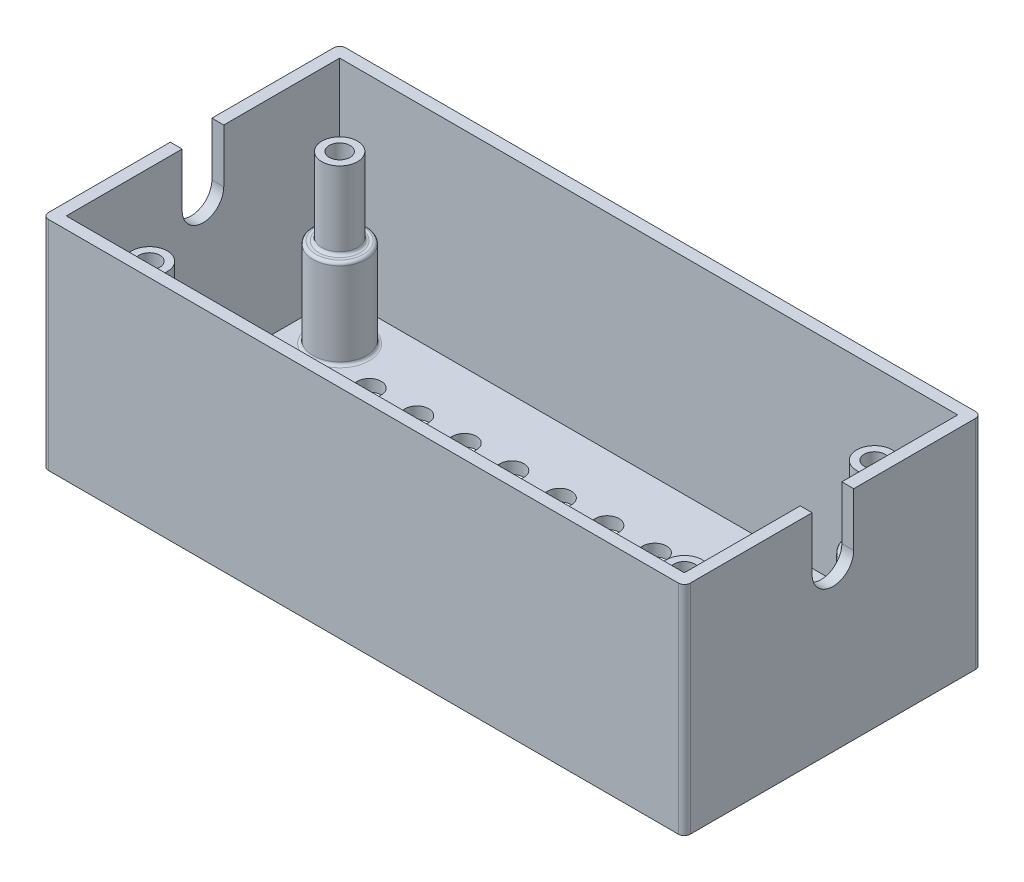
SolidWorks part; units mm, degrees
ref_plane "Спереди" through (0, 0, 0) normal (0, 0, 1) x (1, 0, 0)
ref_plane "Сверху" through (0, 0, 0) normal (0, 1, 0) x (1, 0, 0)
ref_plane "Справа" through (0, 0, 0) normal (1, 0, 0) x (0, 0, -1)
sketch "Эскиз1" plane through (0, 0, 0) normal (0, 1, 0) x (1, 0, 0)
  line L1 (-54, 25) -> (54, 25)
  line L2 (-54, 25) -> (-54, -25)
  line L3 (-54, -25) -> (54, -25)
  line L4 (54, 25) -> (54, -25)
  line L5 (-54, 25) -> (54, -25) construction
  line L6 (-54, -25) -> (54, 25) construction
  point P0 (0, 0)
  dimension "D1" = 108
  dimension "D2" = 50
extrude "Бобышка-Вытянуть1" add sketch "Эскиз1" along normal blind 2
sketch "Эскиз2" plane through (0, 2, 0) normal (0, 1, 0) x (1, 0, 0)
  line L0 (52, 23) -> (-52, 23)
  line L1 (-52, 23) -> (-52, -23)
  line L2 (-52, -23) -> (52, -23)
  line L3 (52, -23) -> (52, 23)
  line L4 (54, -25) -> (54, 25)
  line L5 (54, 25) -> (-54, 25)
  line L6 (-54, 25) -> (-54, -25)
  line L7 (-54, -25) -> (54, -25)
  line L8 (54, -25) -> (54, 25)
  line L9 (54, 25) -> (-54, 25)
  line L10 (-54, 25) -> (-54, -25)
  line L11 (-54, -25) -> (54, -25)
  dimension "D1" = 0
  dimension "D2" = 2
extrude "Бобышка-Вытянуть2" add sketch "Эскиз2" along normal blind 34.6
sketch "Эскиз3" plane through (0, 2, 0) normal (0, 1, 0) x (1, 0, 0)
  line L1 (-45, 16) -> (45, 16) construction
  line L2 (-45, 16) -> (-45, -16) construction
  line L3 (-45, -16) -> (45, -16) construction
  line L4 (45, 16) -> (45, -16) construction
  line L5 (-45, 16) -> (45, -16) construction
  line L6 (-45, -16) -> (45, 16) construction
  circle A0 centre (-45, 16) radius 3
  circle A1 centre (45, 16) radius 3
  circle A2 centre (45, -16) radius 3
  circle A3 centre (-45, -16) radius 3
  point P0 (0, 0)
  dimension "D3" = 6
  dimension "D1" = 32
  dimension "D2" = 90
extrude "Бобышка-Вытянуть3" add sketch "Эскиз3" along normal blind 28
sketch "Эскиз4" plane through (0, 30, 0) normal (0, 1, 0) x (1, 0, 0)
  circle A0 centre (-45, 16) radius 1.75
  circle A1 centre (45, 16) radius 1.75
  circle A2 centre (45, -16) radius 1.75
  circle A3 centre (-45, -16) radius 1.75
  dimension "D1" = 3.5
extrude "Вырез-Вытянуть1" cut sketch "Эскиз4" against normal through all
sketch "Эскиз5" plane through (0, 0, 0) normal (0, -1, 0) x (1, 0, 0)
  circle A0 centre (-45, 16) radius 2.95
  circle A1 centre (-45, -16) radius 2.95
  circle A2 centre (45, -16) radius 2.95
  circle A3 centre (45, 16) radius 2.95
  dimension "D1" = 5.9
extrude "Вырез-Вытянуть2" cut sketch "Эскиз5" against normal blind 15
sketch "Эскиз6" plane through (0, 2, 0) normal (0, 1, 0) x (1, 0, 0)
  circle A0 centre (-45, 16) radius 4.5
  circle A1 centre (45, 16) radius 4.5
  circle A2 centre (45, -16) radius 4.5
  circle A3 centre (-45, -16) radius 4.5
  circle A4 centre (45, -16) radius 3 construction
  circle A5 centre (45, 16) radius 3 construction
  circle A6 centre (-45, -16) radius 3 construction
  circle A7 centre (-45, 16) radius 3 construction
  circle A8 centre (45, -16) radius 3
  circle A9 centre (45, 16) radius 3
  circle A10 centre (-45, -16) radius 3
  circle A11 centre (-45, 16) radius 3
  dimension "D1" = 9
extrude "Бобышка-Вытянуть4" add sketch "Эскиз6" along normal blind 15
sketch "Эскиз7" plane through (-54, 0, 0) normal (-1, 0, 0) x (0, 0, 1)
  line L0 (0, 36.6) -> (0, 0) construction
  line L1 (-25, 36.6) -> (25, 36.6) construction
  line L2 (-25, 0) -> (25, 0) construction
  line L3 (-3.5, 36.6) -> (3.5, 36.6)
  line L4 (-3.5, 36.6) -> (-3.5, 27.6)
  line L5 (-3.5, 27.6) -> (3.5, 27.6) construction
  line L6 (3.5, 27.6) -> (3.5, 36.6)
  arc A0 (-3.5, 27.6) -> (3.5, 27.6) centre (0, 27.6) ccw
  point P8 (0, 36.6)
  dimension "D1" = 7
  dimension "D2" = 9
extrude "Вырез-Вытянуть3" cut sketch "Эскиз7" against normal through all
sketch "Эскиз8" plane through (0, 0, 0) normal (0, -1, 0) x (1, 0, 0)
  line L0 (0, 25) -> (0, -25) construction
  line L1 (-54, 25) -> (54, 25) construction
  line L2 (54, -25) -> (-54, -25) construction
  line L3 (-4, 25) -> (-4, -25) construction
  line L4 (-54, 4) -> (54, 4) construction
  line L5 (-54, -25) -> (-54, 25) construction
  line L6 (54, 25) -> (54, -25) construction
  line L7 (-54, 0) -> (54, 0) construction
  line L8 (-4, 4) -> (-4, 12) construction
  line L9 (-6, 4) -> (-6, 12)
  line L10 (-2, 4) -> (-2, 12)
  line L13 (-12, 4) -> (-12, 12) construction
  line L16 (-14, 4) -> (-14, 12)
  line L19 (-10, 4) -> (-10, 12)
  line L22 (-20, 4) -> (-20, 12) construction
  line L25 (-22, 4) -> (-22, 12)
  line L28 (-18, 4) -> (-18, 12)
  line L31 (-28, 4) -> (-28, 12) construction
  line L34 (-30, 4) -> (-30, 12)
  line L37 (-26, 4) -> (-26, 12)
  line L38 (-36, 4) -> (-36, 12) construction
  line L41 (-38, 4) -> (-38, 12)
  line L44 (-34, 4) -> (-34, 12)
  line L47 (-12, -12) -> (-12, -4) construction
  line L50 (-14, -12) -> (-14, -4)
  line L53 (-10, -12) -> (-10, -4)
  line L56 (-20, -12) -> (-20, -4) construction
  line L59 (-22, -12) -> (-22, -4)
  line L62 (-18, -12) -> (-18, -4)
  line L65 (-28, -12) -> (-28, -4) construction
  line L68 (-30, -12) -> (-30, -4)
  line L69 (-26, -12) -> (-26, -4)
  line L70 (-36, -12) -> (-36, -4) construction
  line L71 (-38, -12) -> (-38, -4)
  line L72 (-34, -12) -> (-34, -4)
  line L73 (-4, -12) -> (-4, -4) construction
  line L74 (-6, -12) -> (-6, -4)
  line L75 (-2, -12) -> (-2, -4)
  line L76 (54, -4) -> (-54, -4) construction
  line L77 (4, -12) -> (4, -4) construction
  line L78 (6, -12) -> (6, -4)
  line L79 (2, -12) -> (2, -4)
  line L80 (36, -12) -> (36, -4) construction
  line L81 (38, -12) -> (38, -4)
  line L82 (34, -12) -> (34, -4)
  line L83 (28, -12) -> (28, -4) construction
  line L84 (30, -12) -> (30, -4)
  line L85 (26, -12) -> (26, -4)
  line L86 (20, -12) -> (20, -4) construction
  line L87 (22, -12) -> (22, -4)
  line L88 (18, -12) -> (18, -4)
  line L89 (12, -12) -> (12, -4) construction
  line L90 (14, -12) -> (14, -4)
  line L91 (10, -12) -> (10, -4)
  line L92 (36, 4) -> (36, 12) construction
  line L93 (38, 4) -> (38, 12)
  line L94 (34, 4) -> (34, 12)
  line L95 (28, 4) -> (28, 12) construction
  line L96 (30, 4) -> (30, 12)
  line L97 (26, 4) -> (26, 12)
  line L98 (20, 4) -> (20, 12) construction
  line L99 (22, 4) -> (22, 12)
  line L100 (18, 4) -> (18, 12)
  line L101 (12, 4) -> (12, 12) construction
  line L102 (14, 4) -> (14, 12)
  line L103 (10, 4) -> (10, 12)
  line L104 (4, 4) -> (4, 12) construction
  line L105 (6, 4) -> (6, 12)
  line L106 (2, 4) -> (2, 12)
  arc A0 (-6, 4) -> (-2, 4) centre (-4, 4) ccw
  arc A1 (-2, 12) -> (-6, 12) centre (-4, 12) ccw
  arc A40 (-14, 4) -> (-10, 4) centre (-12, 4) ccw
  arc A41 (-10, 12) -> (-14, 12) centre (-12, 12) ccw
  arc A42 (-22, 4) -> (-18, 4) centre (-20, 4) ccw
  arc A43 (-18, 12) -> (-22, 12) centre (-20, 12) ccw
  arc A44 (-30, 4) -> (-26, 4) centre (-28, 4) ccw
  arc A45 (-26, 12) -> (-30, 12) centre (-28, 12) ccw
  arc A46 (-38, 4) -> (-34, 4) centre (-36, 4) ccw
  arc A47 (-34, 12) -> (-38, 12) centre (-36, 12) ccw
  arc A48 (-14, -12) -> (-10, -12) centre (-12, -12) ccw
  arc A49 (-10, -4) -> (-14, -4) centre (-12, -4) ccw
  arc A50 (-22, -12) -> (-18, -12) centre (-20, -12) ccw
  arc A51 (-18, -4) -> (-22, -4) centre (-20, -4) ccw
  arc A52 (-30, -12) -> (-26, -12) centre (-28, -12) ccw
  arc A53 (-26, -4) -> (-30, -4) centre (-28, -4) ccw
  arc A54 (-38, -12) -> (-34, -12) centre (-36, -12) ccw
  arc A55 (-34, -4) -> (-38, -4) centre (-36, -4) ccw
  arc A56 (-6, -12) -> (-2, -12) centre (-4, -12) ccw
  arc A57 (-2, -4) -> (-6, -4) centre (-4, -4) ccw
  arc A58 (6, -12) -> (2, -12) centre (4, -12) cw
  arc A59 (2, -4) -> (6, -4) centre (4, -4) cw
  arc A60 (38, -12) -> (34, -12) centre (36, -12) cw
  arc A61 (34, -4) -> (38, -4) centre (36, -4) cw
  arc A62 (30, -12) -> (26, -12) centre (28, -12) cw
  arc A63 (26, -4) -> (30, -4) centre (28, -4) cw
  arc A64 (22, -12) -> (18, -12) centre (20, -12) cw
  arc A65 (18, -4) -> (22, -4) centre (20, -4) cw
  arc A66 (14, -12) -> (10, -12) centre (12, -12) cw
  arc A67 (10, -4) -> (14, -4) centre (12, -4) cw
  arc A68 (38, 4) -> (34, 4) centre (36, 4) cw
  arc A69 (34, 12) -> (38, 12) centre (36, 12) cw
  arc A70 (30, 4) -> (26, 4) centre (28, 4) cw
  arc A71 (26, 12) -> (30, 12) centre (28, 12) cw
  arc A72 (22, 4) -> (18, 4) centre (20, 4) cw
  arc A73 (18, 12) -> (22, 12) centre (20, 12) cw
  arc A74 (14, 4) -> (10, 4) centre (12, 4) cw
  arc A75 (10, 12) -> (14, 12) centre (12, 12) cw
  arc A76 (6, 4) -> (2, 4) centre (4, 4) cw
  arc A77 (2, 12) -> (6, 12) centre (4, 12) cw
  point P19 (-4, 8)
  point P28 (-12, 8)
  point P35 (-20, 8)
  point P42 (-28, 8)
  point P49 (-36, 8)
  point P56 (-12, -8)
  point P63 (-20, -8)
  point P70 (-28, -8)
  point P77 (-36, -8)
  point P84 (-4, -8)
  point P90 (4, -8)
  point P97 (36, -8)
  point P104 (28, -8)
  point P111 (20, -8)
  point P118 (12, -8)
  point P125 (36, 8)
  point P132 (28, 8)
  point P139 (20, 8)
  point P146 (12, 8)
  point P153 (4, 8)
extrude "Вырез-Вытянуть4" cut sketch "Эскиз8" against normal up to next
sketch "Эскиз9" plane through (-54, 0, 0) normal (-1, 0, 0) x (0, 0, 1)
  line L0 (0, 24.1) -> (0, 0) construction
  line L1 (-25, 0) -> (25, 0) construction
  line L3 (-11, 20.05) -> (11, 20.05)
  line L4 (-11, 20.05) -> (-11, 4.05)
  line L5 (-11, 4.05) -> (11, 4.05)
  line L6 (11, 20.05) -> (11, 4.05)
  line L7 (-11, 20.05) -> (11, 4.05) construction
  line L8 (-11, 4.05) -> (11, 20.05) construction
  arc A0 (-3.5, 27.6) -> (3.5, 27.6) centre (0, 27.6) ccw construction
  point P7 (0, 12.05)
  dimension "D1" = 22
  dimension "D2" = 16
extrude "Вырез-Вытянуть5" cut sketch "Эскиз9" against normal blind 0.5
sketch "Эскиз10" plane through (-53.5, 0, 0) normal (-1, 0, 0) x (0, 0, 1)
  line L0 (0, 20.05) -> (0, 4.05) construction
  line L1 (11, 20.05) -> (-11, 20.05) construction
  line L2 (-11, 4.05) -> (11, 4.05) construction
  line L4 (-10, 19.05) -> (10, 19.05)
  line L5 (-10, 19.05) -> (-10, 5.05)
  line L6 (-10, 5.05) -> (10, 5.05)
  line L7 (10, 19.05) -> (10, 5.05)
  line L8 (-10, 19.05) -> (10, 5.05) construction
  line L9 (-10, 5.05) -> (10, 19.05) construction
  point P6 (0, 12.05)
  dimension "D1" = 20
  dimension "D2" = 14
extrude "Вырез-Вытянуть6" cut sketch "Эскиз10" against normal offset from surface (1 mm away) 0.5
fillet "Скругление1" radius 0.5 12 edges at (45, 2, 20.5) (45, 2, -11.5) (-45, 2, 20.5) (-45, 2, -11.5) (-45, 17, 20.5) (-45, 17, 19) (45, 17, 20.5) (45, 17, 19) (45, 17, -11.5) (45, 17, -13) (-45, 17, -11.5) (-45, 17, -13)
sketch "Эскиз11" plane through (0, 15, 0) normal (0, -1, 0) x (1, 0, 0)
  circle A0 centre (-45, 16) radius 1.75
  circle A1 centre (45, 16) radius 1.75
  circle A2 centre (45, -16) radius 1.75
  circle A3 centre (-45, -16) radius 1.7692
  circle A4 centre (45, -16) radius 1.75 construction
extrude "Бобышка-Вытянуть5" add sketch "Эскиз11" against normal blind 0.5
fillet "Скругление2" radius 1 4 edges at (-54, 18.3, -25) (54, 18.3, -25) (54, 18.3, 25) (-54, 18.3, 25)
equation "\"D6@Эскиз8\"=\"D2@Эскиз8\""
